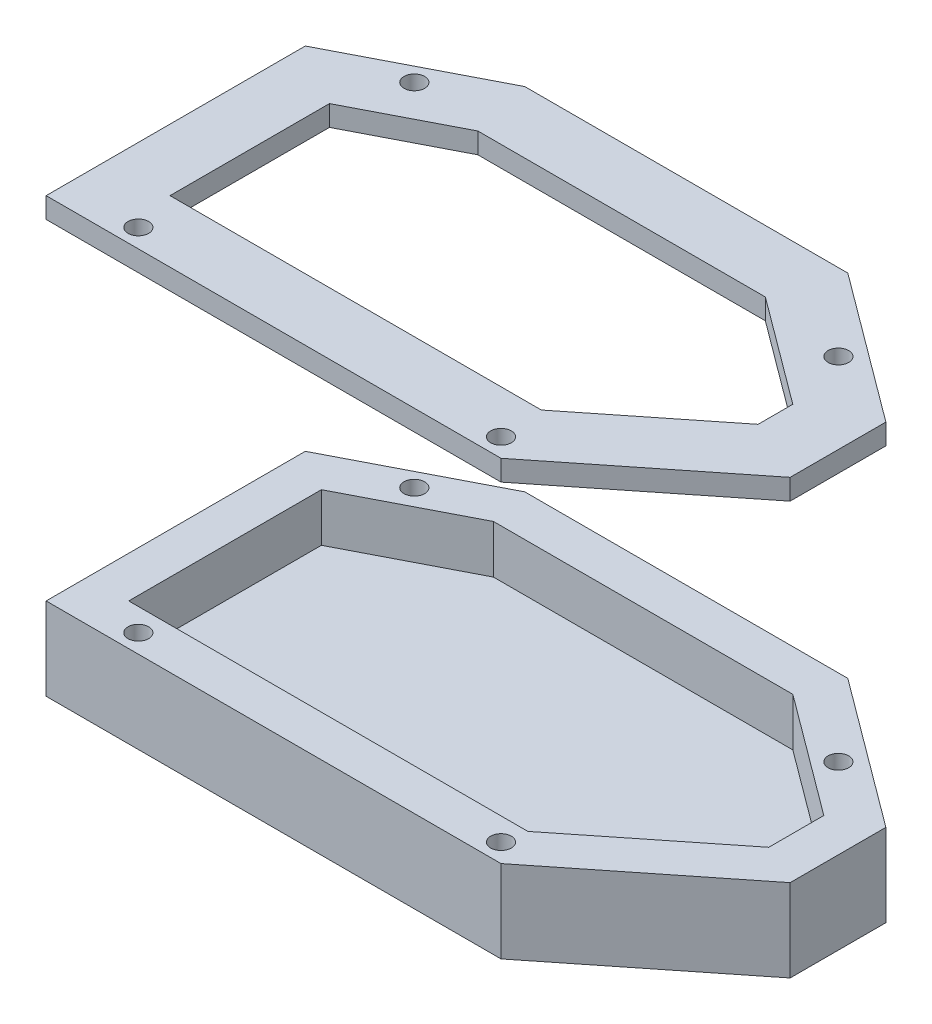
SolidWorks part; units mm, degrees
ref_plane "Alzado" through (0, 0, 0) normal (0, 0, 1) x (1, 0, 0)
ref_plane "Planta" through (0, 0, 0) normal (0, 1, 0) x (1, 0, 0)
ref_plane "Vista lateral" through (0, 0, 0) normal (1, 0, 0) x (0, 0, -1)
sketch "Sketch1" plane through (0, 0, 0) normal (0, 1, 0) x (1, 0, 0)
  line L0 (0, 0) -> (0, 28)
  line L1 (0, -55) -> (0, 55) construction
  line L2 (0, 28) -> (16.5, 36.5)
  line L3 (16.5, 36.5) -> (60, 36.5)
  line L4 (60, 36.5) -> (77.5, 23.5)
  line L5 (77.5, 23.5) -> (77.5, 15.5)
  line L6 (77.5, 15.5) -> (58, 0)
  line L7 (-55, 0) -> (55, 0) construction
  line L8 (58, 0) -> (0, 0)
  point P8 (94.0879, 35.8556)
  dimension "D1" = 36.5
  dimension "D2" = 16.5
  dimension "D3" = 15.5
  dimension "D4" = 13
  dimension "D5" = 8.5
  dimension "D6" = 77.5
  dimension "D7" = 43.5
  dimension "D8" = 19.5
extrude "Boss-Extrude1" add sketch "Sketch1" along normal blind 5
sketch "Sketch2" plane through (0, 5, 0) normal (0, 1, 0) x (1, 0, 0)
  line L7 (0, 28) -> (0, 0) construction
  line L8 (0, 0) -> (58, 0) construction
  line L9 (58, 0) -> (77.5, 15.5) construction
  line L10 (77.5, 15.5) -> (77.5, 23.5) construction
  line L11 (77.5, 23.5) -> (60, 36.5) construction
  line L12 (60, 36.5) -> (16.5, 36.5) construction
  line L13 (16.5, 36.5) -> (0, 28) construction
  line L14 (-6, -6) -> (60.0941, -6)
  line L15 (60.0941, -6) -> (83.5, 12.6047)
  line L16 (83.5, 12.6047) -> (83.5, 26.5172)
  line L17 (83.5, 26.5172) -> (61.9847, 42.5)
  line L18 (61.9847, 42.5) -> (15.0454, 42.5)
  line L19 (15.0454, 42.5) -> (-6, 31.6584)
  line L20 (-6, 31.6584) -> (-6, -6)
  line L21 (-6, -6) -> (60.0941, -6)
  line L22 (60.0941, -6) -> (83.5, 12.6047)
  line L23 (83.5, 12.6047) -> (83.5, 26.5172)
  line L24 (83.5, 26.5172) -> (61.9847, 42.5)
  line L25 (61.9847, 42.5) -> (15.0454, 42.5)
  line L26 (15.0454, 42.5) -> (-6, 31.6584)
  line L27 (-6, 31.6584) -> (-6, -6)
  line L28 (0, 28) -> (0, 0)
  line L29 (0, 0) -> (58, 0)
  line L30 (58, 0) -> (77.5, 15.5)
  line L31 (77.5, 15.5) -> (77.5, 23.5)
  line L32 (77.5, 23.5) -> (60, 36.5)
  line L33 (60, 36.5) -> (16.5, 36.5)
  line L34 (16.5, 36.5) -> (0, 28)
  dimension "D1" = 6
extrude "Boss-Extrude2" add sketch "Sketch2" along normal blind 7 and the other way blind 5
sketch "Sketch4" plane through (0, 12, 0) normal (0, 1, 0) x (1, 0, 0)
  line L0 (-6, -6) -> (60.0941, -6) construction
  line L1 (-6, 31.6584) -> (-6, -6) construction
  circle A0 centre (6.5, 35) radius 1.5
  circle A1 centre (71.8, 31.3172) radius 1.5
  circle A2 centre (4.7, -3.3) radius 1.5
  circle A3 centre (57.3941, -3.3) radius 1.5
  point P15 (57.5365, -3.5)
  point P16 (0, 0)
  dimension "D1" = 3
  dimension "D2" = 7.5
  dimension "D3" = 12.5
  dimension "D4" = 4.8
  dimension "D5" = 11.8
  dimension "D6" = 2.7
  dimension "D7" = 2.7
  dimension "D8" = 2.7
  dimension "D9" = 10.7
extrude "Cut-Extrude1" cut sketch "Sketch4" against normal through all
ref_plane "Plane1" through (0, 60, 0) normal (0, 1, 0) x (1, 0, 0)
sketch "Sketch5" plane through (0, 60, 0) normal (0, 1, 0) x (1, 0, 0)
  line L0 (-6, 31.6584) -> (-6, -6) construction
  line L1 (-6, -6) -> (60.0941, -6) construction
  line L2 (60.0941, -6) -> (83.5, 12.6047) construction
  line L3 (83.5, 12.6047) -> (83.5, 26.5172) construction
  line L4 (83.5, 26.5172) -> (61.9847, 42.5) construction
  line L5 (61.9847, 42.5) -> (15.0454, 42.5) construction
  line L6 (15.0454, 42.5) -> (-6, 31.6584) construction
  line L7 (-6, 31.6584) -> (-6, -6)
  line L8 (-6, -6) -> (60.0941, -6)
  line L9 (60.0941, -6) -> (83.5, 12.6047)
  line L10 (83.5, 12.6047) -> (83.5, 26.5172)
  line L11 (83.5, 26.5172) -> (61.9847, 42.5)
  line L12 (61.9847, 42.5) -> (15.0454, 42.5)
  line L13 (15.0454, 42.5) -> (-6, 31.6584)
  line L49 (3, 26.1708) -> (3, 3)
  line L50 (3, 3) -> (56.9529, 3)
  line L51 (56.9529, 3) -> (74.5, 16.9477)
  line L52 (74.5, 16.9477) -> (74.5, 21.9914)
  line L53 (74.5, 21.9914) -> (59.0076, 33.5)
  line L54 (59.0076, 33.5) -> (17.2273, 33.5)
  line L55 (17.2273, 33.5) -> (3, 26.1708)
  line L56 (3, 26.1708) -> (3, 3)
  line L57 (3, 3) -> (56.9529, 3)
  line L58 (56.9529, 3) -> (74.5, 16.9477)
  line L59 (74.5, 16.9477) -> (74.5, 21.9914)
  line L60 (74.5, 21.9914) -> (59.0076, 33.5)
  line L61 (59.0076, 33.5) -> (17.2273, 33.5)
  line L62 (17.2273, 33.5) -> (3, 26.1708)
  circle A0 centre (6.5, 35) radius 1.5 construction
  circle A1 centre (4.7, -3.3) radius 1.5 construction
  circle A2 centre (57.3941, -3.3) radius 1.5 construction
  circle A3 centre (71.8, 31.3172) radius 1.5 construction
  circle A4 centre (6.5, 35) radius 1.5
  circle A5 centre (4.7, -3.3) radius 1.5
  circle A6 centre (57.3941, -3.3) radius 1.5
  circle A7 centre (71.8, 31.3172) radius 1.5
  dimension "D1" = 3
extrude "Boss-Extrude3" add sketch "Sketch5" along normal blind 3 separate body
